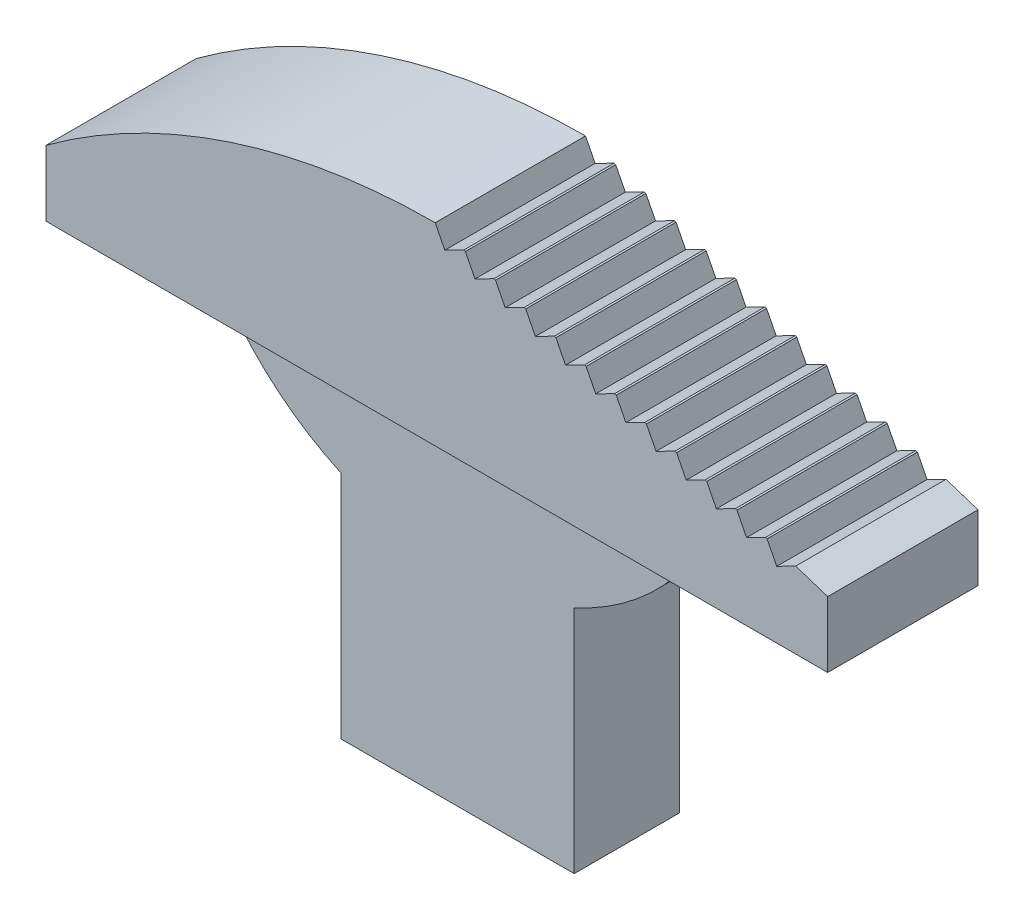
SolidWorks part; units mm, degrees
ref_plane "Front Plane" through (0, 0, 0) normal (0, 0, 1) x (1, 0, 0)
ref_plane "Top Plane" through (0, 0, 0) normal (0, 1, 0) x (1, 0, 0)
ref_plane "Right Plane" through (0, 0, 0) normal (1, 0, 0) x (0, 0, -1)
sketch "Sketch1" plane through (0, 0, 0) normal (0, 0, 1) x (1, 0, 0)
  line L0 (0, 0) -> (2.1573, 0)
  line L1 (10.5664, 0) -> (10.5664, 0.889)
  line L2 (10.5664, 0.889) -> (5.261, 2.6128)
  line L3 (0, 0) -> (0, 0.889)
  line L4 (3.6862, -4.3722) -> (3.6862, -1.2595)
  line L5 (3.6862, -4.3722) -> (6.8358, -4.3722)
  line L6 (6.8358, -4.3722) -> (6.8358, -1.2595)
  line L7 (5.261, 2.6128) -> (5.261, -9.6771) construction
  line L8 (8.3647, 0) -> (10.5664, 0)
  arc A0 (0, 0.889) -> (5.261, 2.6128) centre (5.261, -6.2772) cw
  arc A1 (2.1573, 0) -> (3.6862, -1.2595) centre (5.261, 2.2098) ccw
  arc A2 (6.8358, -1.2595) -> (8.3647, 0) centre (5.261, 2.2098) ccw
  dimension "D1" = 18
  dimension "D3" = 8.89
  dimension "D6" = 3.81
  dimension "D2" = 0.889
  dimension "D4" = 10.5664
  dimension "D5" = 3.1496
  dimension "D7" = 2.2098
  dimension "D8" = 6.985
extrude "Boss-Extrude1" add sketch "Sketch1" along normal blind 1.4224 contours A0 L2 L1 L8 A2 L6 L5 L4 A1 L0 L3
sketch "Sketch2" plane through (0, 0, 1.4224) normal (0, 0, 1) x (1, 0, 0)
  line L0 (10.5664, 0) -> (0, 0)
  line L1 (0, 0) -> (0, 0.889)
  line L2 (10.5664, 0.889) -> (5.261, 2.6128) construction
  line L3 (5.261, 2.6128) -> (10.5664, 0.889)
  line L4 (10.5664, 0.889) -> (10.5664, 0)
  arc A0 (0, 0.889) -> (5.261, 2.6128) centre (5.261, -6.2772) cw
extrude "Boss-Extrude2" add sketch "Sketch2" along normal mid plane 2.032 from offset 0.7112 contours L0 L1 A0 L3 L4
ref_plane "Plane1" through (0, 0, 1.7272) normal (0, 0, 1) x (0.9511, -0.309, 0)
sketch "Sketch3" plane through (0, 0, 1.7272) normal (0, 0, 1) x (0.9511, -0.309, 0)
  line L0 (4.1961, 4.1107) -> (4.3993, 3.9075)
  line L1 (4.3993, 3.9075) -> (4.6025, 4.1107)
  line L2 (4.1961, 4.1107) -> (9.7745, 4.1107) construction
  line L3 (4.3993, 4.1107) -> (4.3993, 3.9075) construction
  line L4 (4.1961, 4.1107) -> (4.6025, 4.1107)
  line L5 (9.3427, 4.5652) -> (9.3427, 2.6267) construction
  line L6 (4.8281, 3.9075) -> (5.0313, 4.1107)
  line L7 (4.6249, 4.1107) -> (4.8281, 3.9075)
  line L8 (4.6249, 4.1107) -> (5.0313, 4.1107)
  line L9 (5.257, 3.9075) -> (5.4602, 4.1107)
  line L10 (5.0538, 4.1107) -> (5.257, 3.9075)
  line L11 (5.0538, 4.1107) -> (5.4602, 4.1107)
  line L12 (5.6858, 3.9075) -> (5.889, 4.1107)
  line L13 (5.4826, 4.1107) -> (5.6858, 3.9075)
  line L14 (5.4826, 4.1107) -> (5.889, 4.1107)
  line L15 (6.1146, 3.9075) -> (6.3178, 4.1107)
  line L16 (5.9114, 4.1107) -> (6.1146, 3.9075)
  line L17 (5.9114, 4.1107) -> (6.3178, 4.1107)
  line L18 (6.5435, 3.9075) -> (6.7467, 4.1107)
  line L19 (6.3403, 4.1107) -> (6.5435, 3.9075)
  line L20 (6.3403, 4.1107) -> (6.7467, 4.1107)
  line L21 (6.9723, 3.9075) -> (7.1755, 4.1107)
  line L22 (6.7691, 4.1107) -> (6.9723, 3.9075)
  line L23 (6.7691, 4.1107) -> (7.1755, 4.1107)
  line L24 (7.4012, 3.9075) -> (7.6044, 4.1107)
  line L25 (7.198, 4.1107) -> (7.4012, 3.9075)
  line L26 (7.198, 4.1107) -> (7.6044, 4.1107)
  line L27 (7.83, 3.9075) -> (8.0332, 4.1107)
  line L28 (7.6268, 4.1107) -> (7.83, 3.9075)
  line L29 (7.6268, 4.1107) -> (8.0332, 4.1107)
  line L30 (8.2588, 3.9075) -> (8.462, 4.1107)
  line L31 (8.0556, 4.1107) -> (8.2588, 3.9075)
  line L32 (8.0556, 4.1107) -> (8.462, 4.1107)
  line L33 (8.6877, 3.9075) -> (8.8909, 4.1107)
  line L34 (8.4845, 4.1107) -> (8.6877, 3.9075)
  line L35 (8.4845, 4.1107) -> (8.8909, 4.1107)
  line L36 (9.1165, 3.9075) -> (9.3197, 4.1107)
  line L37 (8.9133, 4.1107) -> (9.1165, 3.9075)
  line L38 (8.9133, 4.1107) -> (9.3197, 4.1107)
  line L39 (4.3993, 3.9075) -> (4.8281, 3.9075) construction
  dimension "D1" = 0.4064
  dimension "D2" = 0.2032
  dimension "D3" = 0.4318
  dimension "D4" = 0.4288
extrude "Cut-Extrude1" cut sketch "Sketch3" against normal through all
